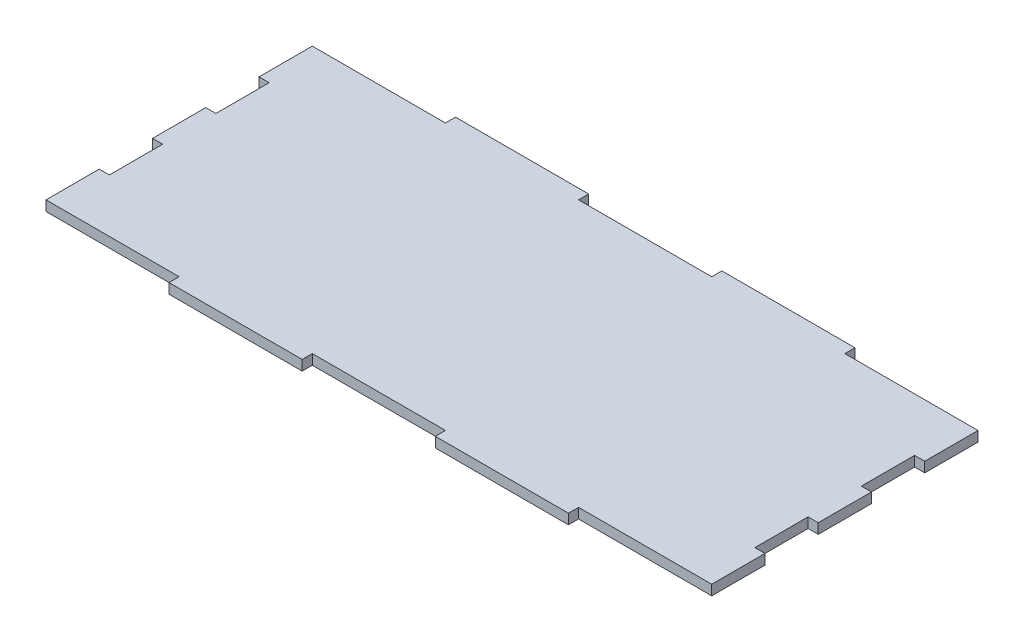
SolidWorks part; units mm, degrees
ref_plane "Alzado" through (0, 0, 0) normal (0, 0, 1) x (1, 0, 0)
ref_plane "Planta" through (0, 0, 0) normal (0, 1, 0) x (1, 0, 0)
ref_plane "Vista lateral" through (0, 0, 0) normal (1, 0, 0) x (0, 0, -1)
sketch "Sketch3" plane through (0, 0, 0) normal (0, 1, 0) x (1, 0, 0)
  line L0 (-45, -30) -> (-45, -32.28)
  line L5 (-75, 30) -> (75, -30) construction
  line L6 (-75, -30) -> (75, 30) construction
  line L7 (-45, -32.28) -> (-15, -32.28)
  line L8 (-15, -32.28) -> (-15, -30)
  line L9 (-15, -30) -> (15, -30)
  line L10 (15, -30) -> (15, -32.28)
  line L11 (15, -32.28) -> (45, -32.28)
  line L12 (45, -32.28) -> (45, -30)
  line L13 (45, -30) -> (74.5584, -30)
  line L14 (74.5584, -30) -> (75, -30)
  line L15 (75, -30) -> (75, -18)
  line L16 (75, -18) -> (72.72, -18)
  line L17 (72.72, -18) -> (72.72, -6)
  line L18 (72.72, -6) -> (75, -6)
  line L19 (75, -6) -> (75, 6)
  line L20 (75, 6) -> (72.72, 6)
  line L21 (72.72, 6) -> (72.72, 18)
  line L22 (72.72, 18) -> (75, 18)
  line L23 (75, 18) -> (75, 30)
  line L24 (45, 30) -> (45, 32.28)
  line L25 (45, 32.28) -> (15, 32.28)
  line L26 (15, 32.28) -> (15, 30)
  line L27 (15, 30) -> (-15, 30)
  line L28 (-15, 30) -> (-15, 32.28)
  line L29 (-15, 32.28) -> (-45, 32.28)
  line L30 (-45, 32.28) -> (-45, 30)
  line L31 (-45, 30) -> (-75, 30)
  line L32 (-75, 18) -> (-72.72, 18)
  line L33 (-72.72, 18) -> (-72.72, 6)
  line L34 (-72.72, 6) -> (-75, 6)
  line L35 (-75, 6) -> (-75, -6)
  line L36 (-75, -6) -> (-72.72, -6)
  line L37 (-72.72, -6) -> (-72.72, -18)
  line L38 (-72.72, -18) -> (-75, -18)
  line L39 (-75, -18) -> (-75, -30)
  line L40 (-75, -30) -> (-45, -30)
  line L41 (-75, 18) -> (-75, 30)
  line L42 (45, 30) -> (75, 30)
  point P0 (0, 0)
  point P5 (-75, 18)
  point P6 (-75, 6)
  point P8 (-75, -6)
  point P9 (-75, -18)
  point P10 (-45, -30)
  point P11 (-15, -30)
  point P12 (15, -30)
  point P13 (45, -30)
  point P14 (-45, 30)
  point P15 (-15, 30)
  point P16 (15, 30)
  point P17 (45, 30)
  point P18 (75, 18)
  point P19 (75, 6)
  point P20 (75, -6)
  point P21 (75, -18)
extrude "Boss-Extrude1" add sketch "Sketch3" along normal blind 2.28
equation "\"largo\"= 150mm"
equation "\"alto\"= 60mm"
equation "\"madera\"= 2.28mm"
equation "\"D1@Sketch3\"=\"largo\""
equation "\"D2@Sketch3\"=\"alto\""
equation "\"D1@Boss-Extrude1\"=\"madera\""
